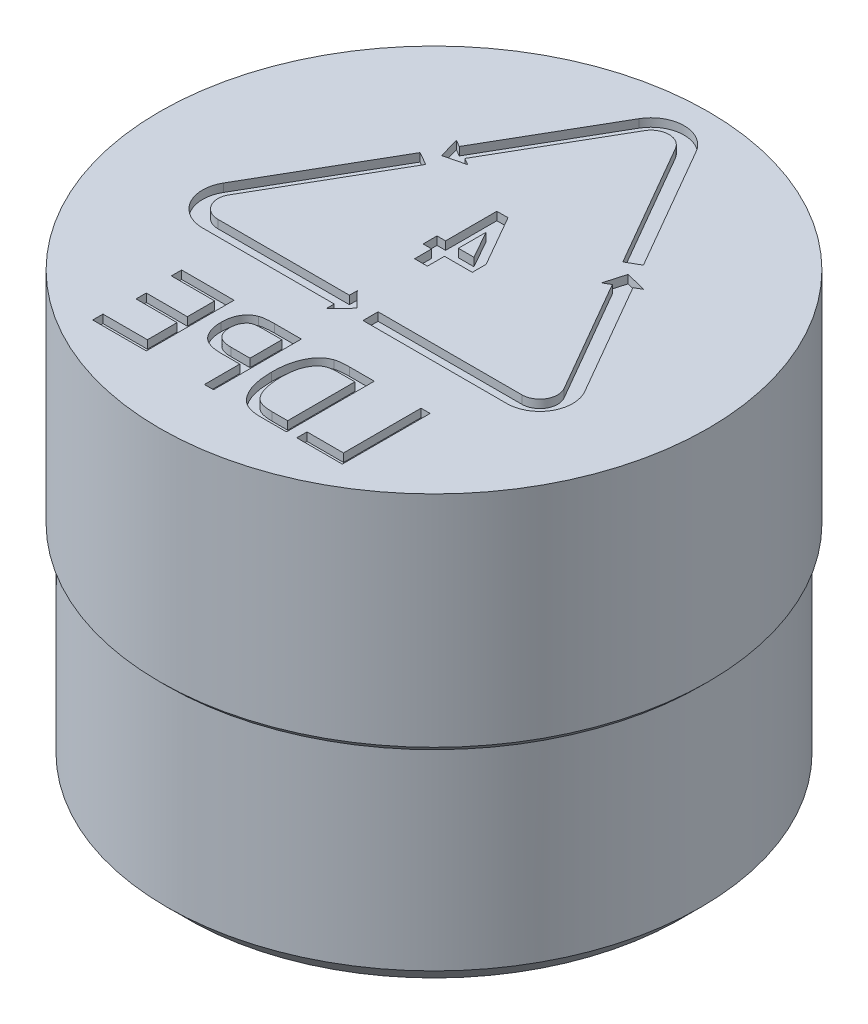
SolidWorks part; units mm, degrees
ref_plane "Front Plane" through (0, 0, 0) normal (0, 0, 1) x (1, 0, 0)
ref_plane "Top Plane" through (0, 0, 0) normal (0, 1, 0) x (1, 0, 0)
ref_plane "Right Plane" through (0, 0, 0) normal (1, 0, 0) x (0, 0, -1)
sketch "Sketch1" plane through (0, 0, 0) normal (0, 0, 1) x (1, 0, 0)
  line L0 (-10, 16) -> (-10, 8)
  line L1 (-10, 8) -> (-9.745, 7.745)
  line L2 (-9.745, 7.745) -> (-9.745, 0)
  line L3 (-9.745, 0) -> (0, 0)
  line L4 (0, 0) -> (0, 16)
  line L5 (0, 16) -> (-10, 16)
  line L6 (0, 36.7698) -> (0, -15.8595) construction
  dimension "D1" = 20
  dimension "D2" = 16
  dimension "D3" = 8
  dimension "D4" = 19.49
  dimension "D5" = 45
revolve "Revolve1" add sketch "Sketch1" angle 360 about L6
chamfer "Chamfer1" distance 0.76 angle 45 1 edges at (0, 0, 9.745)
hole_wizard "M6x1.0 Tapped Hole1" positions "Sketch4" profile "Sketch5" tap size "M6x1.0" standard "ANSI Metric"
sketch "Sketch4" plane through (0, 0, 0) normal (0, -1, 0) x (-1, 0, 0)
  point P0 (0, 0)
sketch "Sketch5" plane through (0, 0, 0) normal (1, 0, 0) x (0, 0, -1)
  line L0 (0, 0) -> (0, 6)
  line L1 (0, 6) -> (2.5, 6)
  line L2 (2.5, 6) -> (2.5, 0)
  line L5 (2.5, 0) -> (0, 0)
  line L10 (0, 6) -> (-2.5, 6) construction
  line L11 (0, -6.35) -> (0, 107.95) construction
  dimension "Tap Drill Dia." = 5
  dimension "Tap Drill Depth" = 6
  dimension "Drill Angle" = 180
sketch "Sketch8" plane through (0, 16, 0) normal (0, 1, 0) x (1, 0, 0)
  line L0 (0.5653, 8.2377) -> (3.1879, 3.6952)
  line L1 (3.1879, 3.6952) -> (3.6642, 3.9702)
  line L2 (3.6642, 3.9702) -> (1.0392, 8.5168)
  line L3 (-3.9596, 3.4545) -> (-6.5846, -1.0921)
  line L4 (-1.0392, 8.5168) -> (-3.4392, 4.3599)
  line L5 (-0.5606, 8.2377) -> (-2.9594, 4.0828)
  line L6 (-3.4392, 4.3599) -> (-3.6875, 4.5032)
  line L7 (-2.9594, 4.0828) -> (-2.7111, 3.9395)
  line L8 (-2.7111, 3.9395) -> (-3.4714, 3.75)
  line L9 (-3.4714, 3.75) -> (-3.6875, 4.5032)
  line L10 (-3.4714, 3.75) -> (0.2283, 3.75) construction
  line L11 (0, 0) -> (0, 7.9168) construction
  line L12 (-0.7454, -2.3381) -> (-0.7454, -2.0513)
  line L13 (-5.5454, -2.8921) -> (-0.7454, -2.8921)
  line L14 (-0.2011, -2.6151) -> (-0.7454, -2.6151) construction
  line L15 (-0.7454, -2.8921) -> (-0.7454, -3.1789)
  line L16 (-6.1059, -1.3631) -> (-3.4833, 3.1795)
  line L17 (-5.543, -2.3381) -> (-0.7454, -2.3381)
  line L18 (-0.7454, -2.0513) -> (-0.2011, -2.6151)
  line L19 (-0.2011, -2.6151) -> (-0.7454, -3.1789)
  line L20 (-4.3041, -0.9755) -> (-5.5454, -1.6921) construction
  line L21 (-3.4833, 3.1795) -> (-3.9596, 3.4545)
  line L22 (-3.4714, 3.75) -> (-3.7214, 3.317) construction
  line L23 (6.5855, -1.0896) -> (4.1858, 3.0668)
  line L24 (5.5463, -2.3396) -> (0.301, -2.3396)
  line L25 (3.7104, 2.7902) -> (3.4625, 2.6461)
  line L26 (0.301, -2.3396) -> (0.301, -2.8896)
  line L27 (0.301, -2.8896) -> (5.5463, -2.8896)
  line L28 (3.6761, 3.3996) -> (4.4336, 3.211)
  line L29 (3.4625, 2.6461) -> (3.6761, 3.3996)
  line L30 (6.1092, -1.3646) -> (3.7104, 2.7902)
  line L31 (4.1858, 3.0668) -> (4.4336, 3.211)
  line L32 (3.7104, 2.7902) -> (4.1858, 3.0668) construction
  line L33 (3.1303, -2.2782) -> (3.095, -2.2698) construction
  line L34 (3.6761, 3.3996) -> (3.9481, 2.9285) construction
  line L35 (3.4261, 3.8327) -> (3.6761, 3.3996) construction
  arc A0 (1.0392, 8.5168) -> (-1.0392, 8.5168) centre (0, 7.9168) ccw
  arc A1 (0.5653, 8.2377) -> (-0.5606, 8.2377) centre (0.0024, 7.9127) ccw
  arc A2 (-6.1059, -1.3631) -> (-5.543, -2.3381) centre (-5.543, -1.6881) ccw
  arc A3 (-6.5846, -1.0921) -> (-5.5454, -2.8921) centre (-5.5454, -1.6921) ccw
  arc A4 (5.5463, -2.3396) -> (6.1092, -1.3646) centre (5.5463, -1.6896) ccw
  arc A5 (5.5463, -2.8896) -> (6.5855, -1.0896) centre (5.5463, -1.6896) ccw
  point P49 (0, 9.1168)
  point P50 (-6.7454, -1.6921)
  point P51 (6.7463, -1.6896)
  dimension "D2" = 1.2
  dimension "D3" = 0.65
  dimension "D13" = 1.2
  dimension "D14" = 0.65
  dimension "D1" = 0.55
  dimension "D4" = 60
  dimension "D5" = 1.1275
  dimension "D6" = 0.5443
  dimension "D7" = 0.2867
  dimension "D8" = 5.25
  dimension "D9" = 3.75
  dimension "D10" = 4.8
  dimension "D11" = 30
  dimension "D12" = 60
  dimension "D15" = 0.5541
  dimension "D16" = 90
  dimension "D17" = 60
  dimension "D18" = 30
  dimension "D19" = 0.5
  dimension "D20" = 0.544
  dimension "D21" = 43.99
  dimension "D22" = 30
  dimension "D23" = 0.5
  dimension "D24" = 0.5443
  dimension "D25" = 13.4916
  dimension "D26" = 12.0089
extrude "Cut-Extrude2" cut sketch "Sketch8" against normal blind 0.3
sketch "Sketch12" plane through (0, 16, 0) normal (0, 1, 0) x (1, 0, 0)
  line L0 (0, 0) -> (0, 0.5402) construction
  line L1 (0, 0) -> (0.8877, 0) construction
  line L2 (0.0024, 8.5627) -> (0.0024, -1.5463) construction
  arc A0 (0.5653, 8.2377) -> (-0.5606, 8.2377) centre (0.0024, 7.9127) ccw construction
  text T0 "<b>4</b>" font "Arial Narrow" height 3
  dimension "D1" = 0.85
  dimension "D2" = 0
extrude "Cut-Extrude3" cut sketch "Sketch12" against normal blind 0.3
sketch "Sketch13" plane through (0, 16, 0) normal (0, 1, 0) x (1, 0, 0)
  text T0 "LDPE" font "Arial Narrow" height 3.2
  dimension "D1" = 7.8
  dimension "D2" = 4.75
extrude "Cut-Extrude4" cut sketch "Sketch13" against normal blind 0.3
